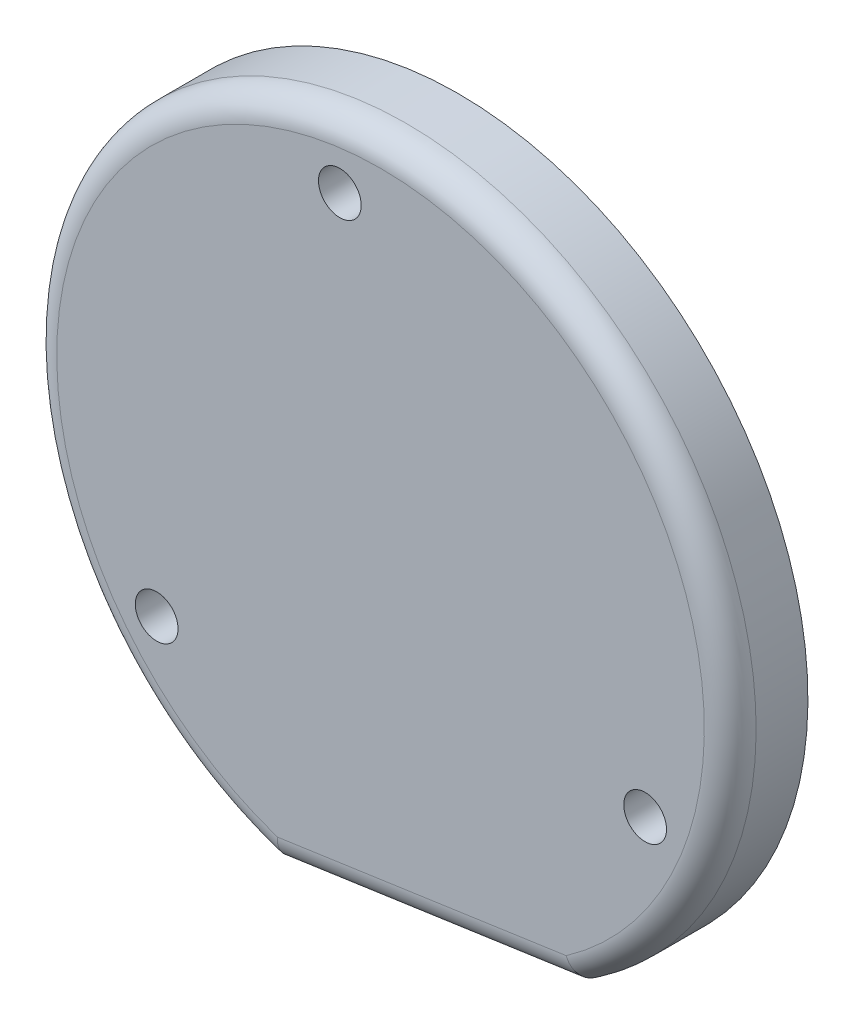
SolidWorks part; units mm, degrees
ref_plane "前视基准面" through (0, 0, 0) normal (0, 0, 1) x (1, 0, 0)
ref_plane "上视基准面" through (0, 0, 0) normal (0, 1, 0) x (1, 0, 0)
ref_plane "右视基准面" through (0, 0, 0) normal (1, 0, 0) x (0, 0, -1)
sketch "草图1" plane through (0, 0, 0) normal (0, 0, 1) x (1, 0, 0)
  circle A1 centre (0, 0) radius 13.204
  circle A3 centre (0, 0) radius 17.5
  dimension "D1" = 26.408
  dimension "D2" = 35
extrude "拉伸1" add sketch "草图1" along normal offset from surface (4.75 mm away) 2
sketch "草图2" plane through (0, 0, 4.75) normal (0, 0, 1) x (1, 0, 0)
  line L0 (15.0836, -22.3938) -> (-8.1353, -25.7452)
  line L2 (-5.6649, -26.399) -> (12.899, -23.7195) construction
  circle A1 centre (0, 0) radius 17.5 construction
  arc A2 (29.3042, -30.6801) -> (-18.4393, -36.3867) centre (8.2858, -57.4051) ccw construction
  arc A3 (-26.9335, -1.8936) -> (-4.5077, 26.6211) centre (0, 0) ccw construction
  arc A4 (15.0836, -22.3938) -> (-8.1353, -25.7452) centre (0, 0) ccw
  dimension "D1" = 54
  dimension "D2" = 1
extrude "拉伸2" add sketch "草图2" along normal blind 6
hole_wizard "M4 螺纹孔1" positions "草图4" profile "草图3" tap size "M4" standard "ISO"
sketch "草图4" plane through (0, 0, 10.75) normal (0, 0, 1) x (1, 0, 0)
  point P1 (-3.1429, 21.7743)
  point P4 (20.4286, -8.1654)
  point P7 (-17.2857, -13.609)
sketch "草图3" plane through (-3.1429, 21.7743, 10.75) normal (1, 0, 0) x (0, -1, 0)
  line L0 (0, 0) -> (0, 10.75)
  line L1 (0, 10.75) -> (1.65, 10.75)
  line L2 (1.65, 10.75) -> (1.65, 0)
  line L5 (1.65, 0) -> (0, 0)
  line L11 (0, -6.35) -> (0, 107.95) construction
  dimension "籵謂蹟恇謂郰芛眻噤" = 3.3
  dimension "籵謂蹟恇謂郰芛旮僅" = 10.75
fillet "圆角1" radius 2 2 edges at (3.4742, -24.0695, 10.75) (-3.8572, 26.7231, 10.75)
